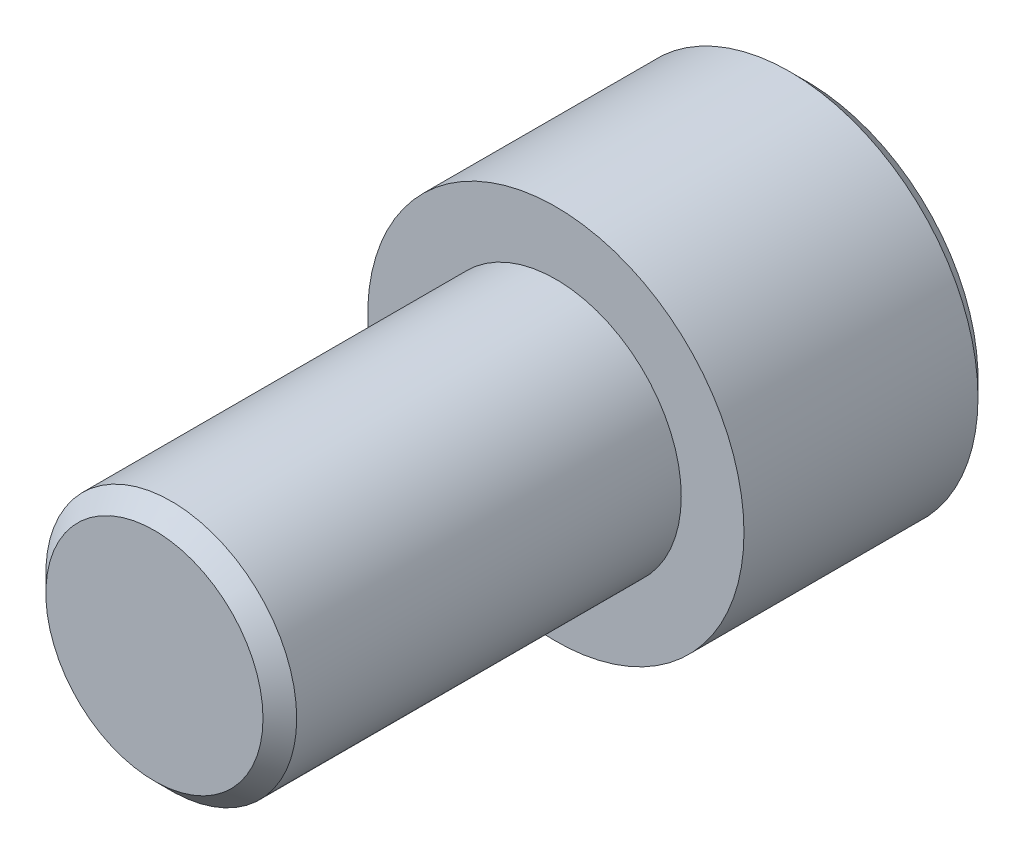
SolidWorks part; units mm, degrees
ref_plane "Front Plane" through (0, 0, 0) normal (0, 0, 1) x (1, 0, 0)
ref_plane "Top Plane" through (0, 0, 0) normal (0, 1, 0) x (1, 0, 0)
ref_plane "Right Plane" through (0, 0, 0) normal (1, 0, 0) x (0, 0, -1)
sketch "Sketch1" plane through (0, 0, 0) normal (0, 1, 0) x (1, 0, 0)
  line L0 (0, -12.7) -> (3.9688, -12.7)
  line L1 (3.9688, -12.7) -> (3.9688, 0)
  line L2 (3.9688, 0) -> (5.9531, 0)
  line L3 (5.9531, 0) -> (5.9531, 7.9375)
  line L4 (5.9531, 7.9375) -> (0, 7.9375)
  line L5 (0, -12.7) -> (0, 0)
  line L6 (0, 0) -> (0, 7.9375)
  dimension "D1" = 3.9688
  dimension "D2" = 5.9531
  dimension "D3" = 7.9375
  dimension "D4" = 12.7
revolve "Revolve1" add sketch "Sketch1" angle 360 about L5
sketch "Sketch2" plane through (0, 0, -7.9375) normal (0, 0, -1) x (-1, 0, 0)
  line L1 (-3.1825, -1.82) -> (-0.0151, -3.6661)
  line L2 (-0.0151, -3.6661) -> (3.1674, -1.8462)
  line L3 (3.1674, -1.8462) -> (3.1825, 1.82)
  line L4 (3.1825, 1.82) -> (0.0151, 3.6661)
  line L5 (0.0151, 3.6661) -> (-3.1674, 1.8462)
  line L6 (-3.1674, 1.8462) -> (-3.1825, -1.82)
  circle A0 centre (0, 0) radius 3.175 construction
  circle A1 centre (0, 0) radius 5.9531 construction
  dimension "D1" = 6.35
extrude "Cut-Extrude1" cut sketch "Sketch2" against normal blind 6.35
chamfer "Chamfer2" distance 0.5334 angle 45 1 edges at (5.9531, 0, -7.9375)
chamfer "Chamfer3" distance 0.5334 angle 45 1 edges at (3.9688, 0, 12.7)
